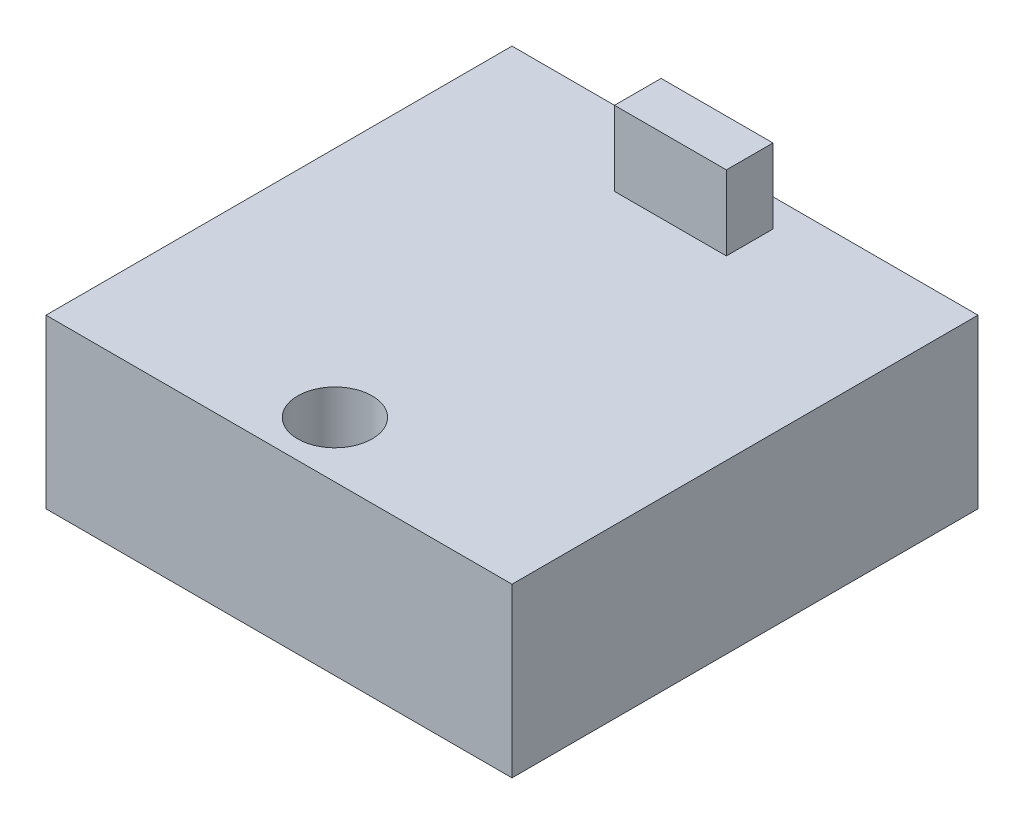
SolidWorks part; units mm, degrees
ref_plane "Front Plane" through (0, 0, 0) normal (0, 0, 1) x (1, 0, 0)
ref_plane "Top Plane" through (0, 0, 0) normal (0, 1, 0) x (1, 0, 0)
ref_plane "Right Plane" through (0, 0, 0) normal (1, 0, 0) x (0, 0, -1)
sketch "Sketch1" plane through (0, 0, 0) normal (0, 1, 0) x (1, 0, 0)
  line L1 (0, 0) -> (50, 0)
  line L2 (0, 0) -> (0, 50)
  line L3 (0, 50) -> (50, 50)
  line L4 (50, 0) -> (50, 50)
  dimension "D1" = 50
extrude "Base" add sketch "Sketch1" along normal blind 18
sketch "Sketch2" plane through (0, 18, 0) normal (0, 1, 0) x (-1, 0, 0)
  line L1 (0, 0) -> (-50, 0) construction
  circle A0 centre (-25, -6) radius 4
  point P6 (-25, 0)
  dimension "D1" = 8
  dimension "D2" = 6
extrude "Hole" cut sketch "Sketch2" against normal blind 8
sketch "Sketch3" plane through (0, 18, 0) normal (0, 1, 0) x (-1, 0, 0)
  line L0 (-25, -42) -> (-25, -47) construction
  line L1 (-19, -47) -> (-31, -47)
  line L2 (-19, -47) -> (-19, -42)
  line L3 (-19, -42) -> (-31, -42)
  line L4 (-31, -47) -> (-31, -42)
  line L6 (-50, -50) -> (0, -50) construction
  point P9 (-25, -50)
  dimension "D1" = 12
  dimension "D2" = 5
  dimension "D3" = 8
extrude "Boss" add sketch "Sketch3" along normal blind 8
